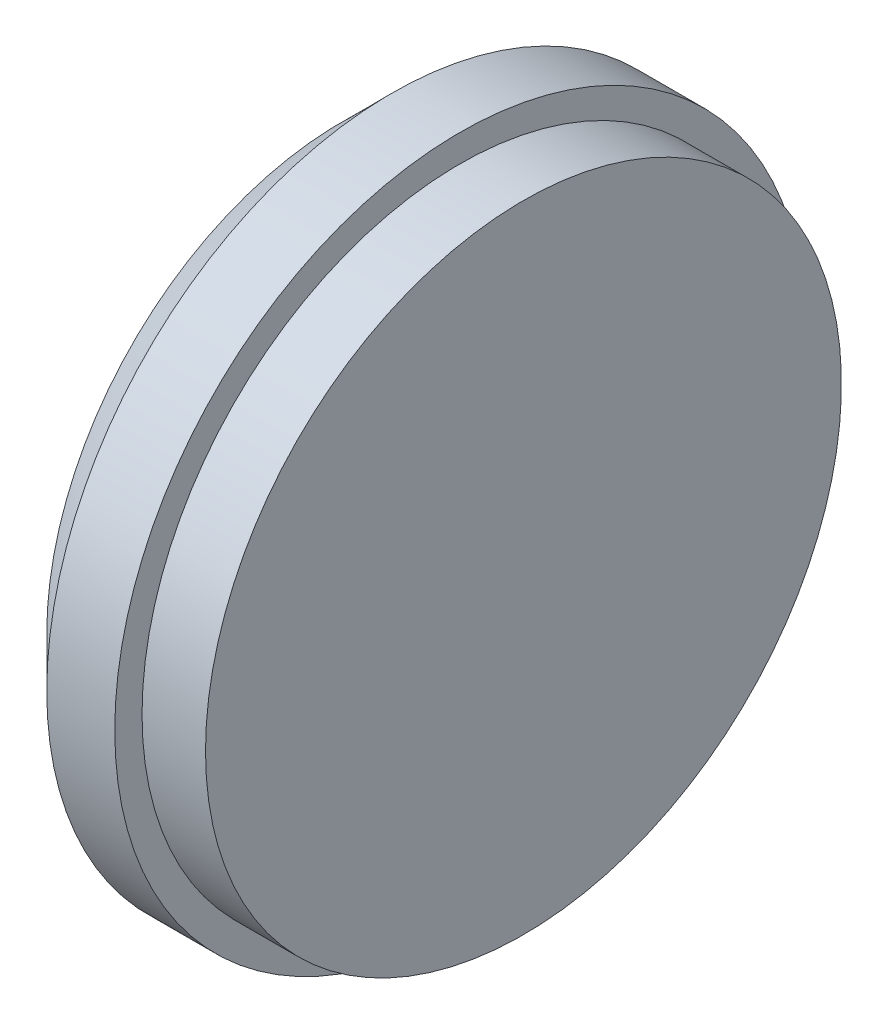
SolidWorks part; units mm, degrees
ref_plane "Front Plane" through (0, 0, 0) normal (0, 0, 1) x (1, 0, 0)
ref_plane "Top Plane" through (0, 0, 0) normal (0, 1, 0) x (1, 0, 0)
ref_plane "Right Plane" through (0, 0, 0) normal (1, 0, 0) x (0, 0, -1)
sketch "Sketch1" plane through (0, 0, 0) normal (0, 0, 1) x (1, 0, 0)
  line L1 (-6.3475, 24.5847) -> (-6.3475, -3.2537)
  line L2 (-6.3475, -3.2537) -> (-11.905, -3.2537)
  line L3 (-11.905, -3.2537) -> (-11.905, -5.6413)
  line L4 (-11.905, -5.6413) -> (-17.8587, -5.6413)
  line L5 (-17.8587, -5.6413) -> (-22.2225, -1.2776)
  line L6 (-22.2225, -1.2776) -> (-22.2225, 24.5847)
  line L7 (-22.2225, 24.5847) -> (-6.3475, 24.5847)
  dimension "D1" = 27.8384
  dimension "D2" = 45
  dimension "D3" = 5.5575
  dimension "D4" = 5.9538
  dimension "D5" = 15.875
  dimension "D6" = 30.226
revolve "Revolve1" add sketch "Sketch1" angle 360 about L7
